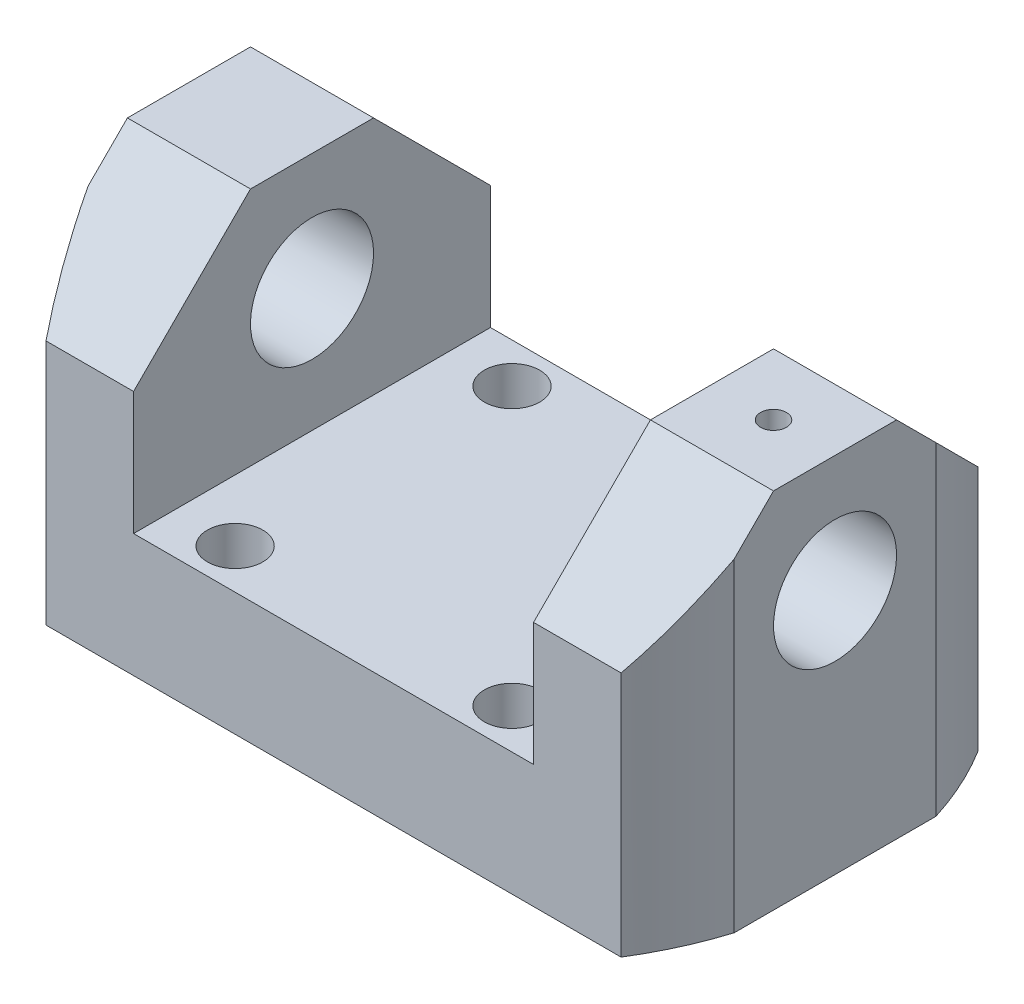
SolidWorks part; units mm, degrees
ref_plane "Plan de face" through (0, 0, 0) normal (0, 0, 1) x (1, 0, 0)
ref_plane "Plan de dessus" through (0, 0, 0) normal (0, 1, 0) x (1, 0, 0)
ref_plane "Plan de droite" through (0, 0, 0) normal (1, 0, 0) x (0, 0, -1)
sketch "Esquisse1" plane through (0, 0, 0) normal (0, 0, 1) x (1, 0, 0)
  line L0 (0, 0) -> (0, 59)
  line L1 (0, 59) -> (20, 59)
  line L2 (20, 59) -> (20, 20)
  line L3 (20, 20) -> (85, 20)
  line L4 (85, 20) -> (85, 59)
  line L5 (85, 59) -> (105, 59)
  line L6 (105, 59) -> (105, 0)
  line L7 (105, 0) -> (0, 0)
  dimension "D1" = 59
  dimension "D2" = 20
  dimension "D3" = 20
  dimension "D4" = 105
  dimension "D5" = 39
extrude "Extrusion1" add sketch "Esquisse1" along normal blind 58
hole_wizard "Diamètre du perçage Ø20.0 (20)1" positions "Esquisse3" profile "Esquisse2" hole size "Ø20.0" standard "ISO"
sketch "Esquisse3" plane through (105, 0, 0) normal (1, 0, 0) x (0, 0, -1)
  line L0 (-29, 60.9309) -> (-29, -2.3028) construction
  line L3 (0, 0) -> (0, 59) construction
  line L4 (-58, 0) -> (-58, 59) construction
  line L5 (-58, 59) -> (0, 59) construction
  point P0 (-29, 40)
  dimension "D1" = 19
sketch "Esquisse2" plane through (105, 40, 29) normal (0, 1, 0) x (0, 0, -1)
  line L0 (0, 0) -> (0, 105)
  line L1 (0, 105) -> (10, 105)
  line L2 (10, 105) -> (10, 0)
  line L5 (10, 0) -> (0, 0)
  line L11 (0, -6.35) -> (0, 107.95) construction
  dimension "Diamètre du perçage jusqu'au prochain" = 20
  dimension "Profondeur du perçage jusqu'au prochain" = 105
hole_wizard "Diamètre du perçage Ø9.0 (9)1" positions "Esquisse5" profile "Esquisse4" hole size "Ø9.0" standard "ISO"
sketch "Esquisse5" plane through (0, 20, 0) normal (0, 1, 0) x (-1, 0, 0)
  line L0 (4.364, 29) -> (-110.7281, 29) construction
  line L2 (-85, 0) -> (-20, 0) construction
  line L3 (-85, 58) -> (-20, 58) construction
  line L4 (-52.5, -6.2097) -> (-52.5, 63.0161) construction
  line L6 (-105, 58) -> (-105, 0) construction
  line L7 (0, 58) -> (0, 0) construction
  circle A0 centre (-52.5, 29) radius 31.8198 construction
  point P0 (-30, 6.5)
  point P40 (-75, 6.5)
  point P41 (-75, 51.5)
  point P42 (-30, 51.5)
  dimension "D1" = 22.5
  dimension "D2" = 22.5
sketch "Esquisse4" plane through (30, 20, 6.5) normal (1, 0, 0) x (0, 0, 1)
  line L0 (0, 0) -> (0, 20)
  line L1 (0, 20) -> (4.5, 20)
  line L2 (4.5, 20) -> (4.5, 0)
  line L5 (4.5, 0) -> (0, 0)
  line L11 (0, -6.35) -> (0, 107.95) construction
  dimension "Diamètre du perçage jusqu'au prochain" = 9
  dimension "Profondeur du perçage jusqu'au prochain" = 20
sketch "Esquisse6" plane through (0, 0, 0) normal (-1, 0, 0) x (0, 0, 1)
  line L0 (39, 59) -> (58, 40)
  line L1 (58, 59) -> (0, 59) construction
  line L2 (58, 59) -> (58, 0) construction
  line L3 (29, 65.1124) -> (29, 28.0649) construction
  line L4 (0, 59) -> (0, 0) construction
  line L5 (39, 59) -> (58, 59)
  line L6 (58, 59) -> (58, 40)
  line L7 (0, 59) -> (0, 40)
  line L8 (19, 59) -> (0, 59)
  line L9 (19, 59) -> (0, 40)
  dimension "D1" = 10
extrude "Extrusion2" cut sketch "Esquisse6" against normal through all
hole_wizard "Trou taraudé M51" positions "Esquisse8" profile "Esquisse9" tap size "M5" standard "ISO"
sketch "Esquisse8" plane through (0, 59, 0) normal (0, 1, 0) x (-1, 0, 0)
  line L0 (-61.5158, 29) -> (-108.8298, 29) construction
  line L2 (-105, 19) -> (-85, 19) construction
  line L3 (-105, 39) -> (-85, 39) construction
  line L4 (-95, 13.9736) -> (-95, 43.2558) construction
  line L6 (-105, 39) -> (-105, 19) construction
  line L8 (-85, 39) -> (-85, 19) construction
  point P0 (-95, 29)
sketch "Esquisse9" plane through (95, 59, 29) normal (1, 0, 0) x (0, 0, 1)
  line L0 (0, 0) -> (0, 9)
  line L1 (0, 9) -> (2.1, 9)
  line L2 (2.1, 9) -> (2.1, 0)
  line L5 (2.1, 0) -> (0, 0)
  line L11 (0, -6.35) -> (0, 107.95) construction
  dimension "Diamètre du trou pour taraudage jusqu'au prochain" = 4.2
  dimension "Profondeur du trou pour taraudage jusqu'au prochain" = 9
sketch "Esquisse10" plane through (0, 20, 0) normal (0, 1, 0) x (1, 0, 0)
  line L0 (37.6596, -29) -> (69.5368, -29) construction
  line L1 (85, 0) -> (20, 0) construction
  line L2 (85, -58) -> (20, -58) construction
  line L3 (52.5, -11.8132) -> (52.5, -38.997) construction
  line L4 (105, -39) -> (105, -19) construction
  line L5 (0, -39) -> (0, -19) construction
  circle A0 centre (52.5, -29) radius 55
  dimension "D1" = 110
extrude "Extrusion4" cut sketch "Esquisse10" against normal through all and the other way through all flip side to cut
